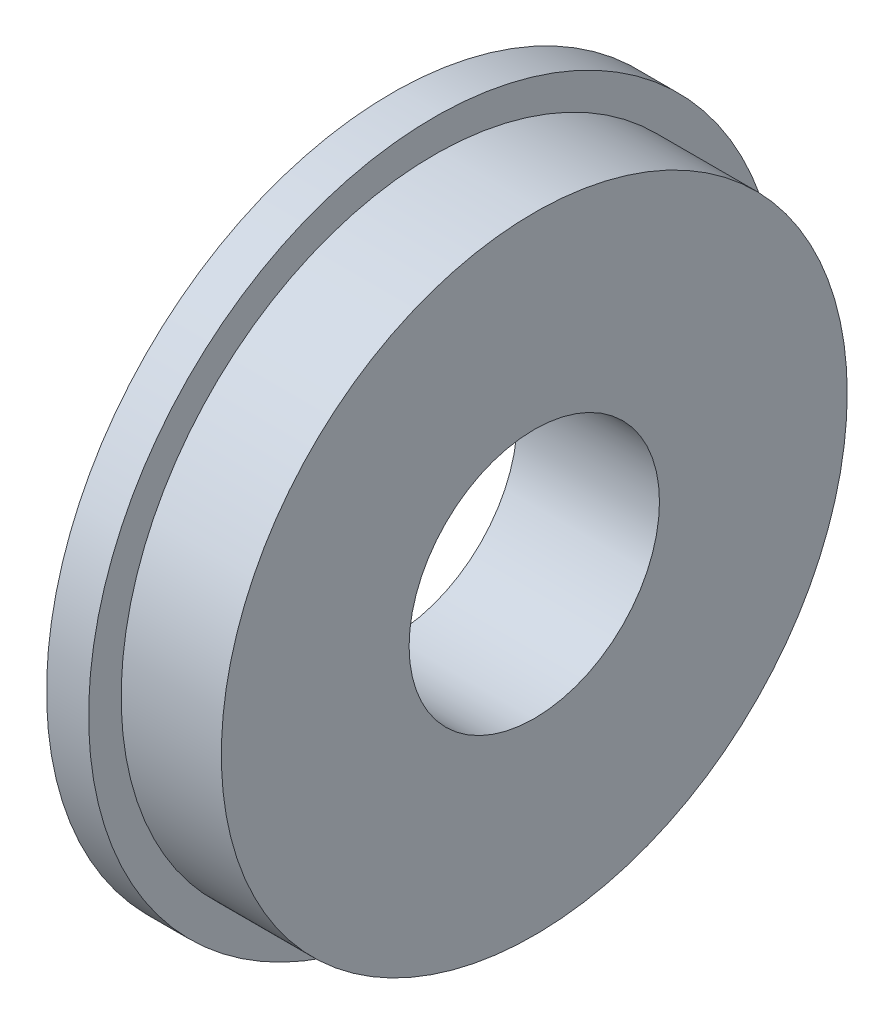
SolidWorks part; units mm, degrees
ref_plane "Front" through (0, 0, 0) normal (0, 0, 1) x (1, 0, 0)
ref_plane "Top" through (0, 0, 0) normal (0, 1, 0) x (1, 0, 0)
ref_plane "Right" through (0, 0, 0) normal (1, 0, 0) x (0, 0, -1)
sketch "Sketch1" plane through (0, 0, 0) normal (0, 1, 0) x (1, 0, 0)
  line L0 (0, 0) -> (-48.3037, 0) construction
  line L1 (0, 7.9375) -> (0, 3.175)
  line L2 (0, 3.175) -> (-3.6068, 3.175)
  line L3 (-3.6068, 3.175) -> (-3.6068, 8.763)
  line L4 (-3.6068, 8.763) -> (-2.54, 8.763)
  line L5 (-2.54, 8.763) -> (-2.54, 7.9375)
  line L6 (-2.54, 7.9375) -> (0, 7.9375)
  dimension "D1" = 6.35
  dimension "D2" = 15.875
  dimension "D3" = 1.0668
  dimension "D4" = 3.6068
  dimension "D5" = 17.526
revolve "Revolve1" add sketch "Sketch1" angle 360 about L0
